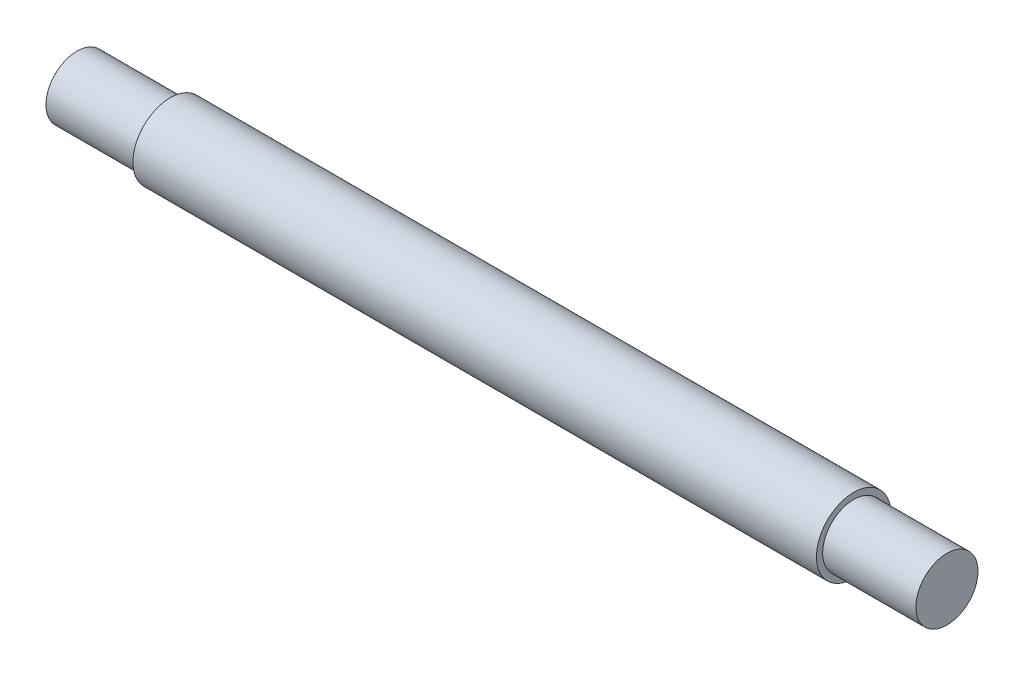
SolidWorks part; units mm, degrees
ref_plane "Plan de face" through (0, 0, 0) normal (0, 0, 1) x (1, 0, 0)
ref_plane "Plan de dessus" through (0, 0, 0) normal (0, 1, 0) x (1, 0, 0)
ref_plane "Plan de droite" through (0, 0, 0) normal (1, 0, 0) x (0, 0, -1)
sketch "Esquisse1" plane through (0, 0, 0) normal (0, 0, 1) x (1, 0, 0)
  line L0 (0, 0) -> (-140, 0)
  line L1 (-140, 0) -> (-140, 5)
  line L2 (-140, 5) -> (-125, 5)
  line L3 (-125, 5) -> (-125, 6)
  line L4 (-125, 6) -> (-15, 6)
  line L5 (-15, 6) -> (-15, 5)
  line L6 (-15, 5) -> (0, 5)
  line L7 (0, 5) -> (0, 0)
  dimension "D1" = 140
  dimension "D2" = 5
  dimension "D3" = 1
  dimension "D4" = 15
revolve "Révolution1" add sketch "Esquisse1" angle 360 about L0
